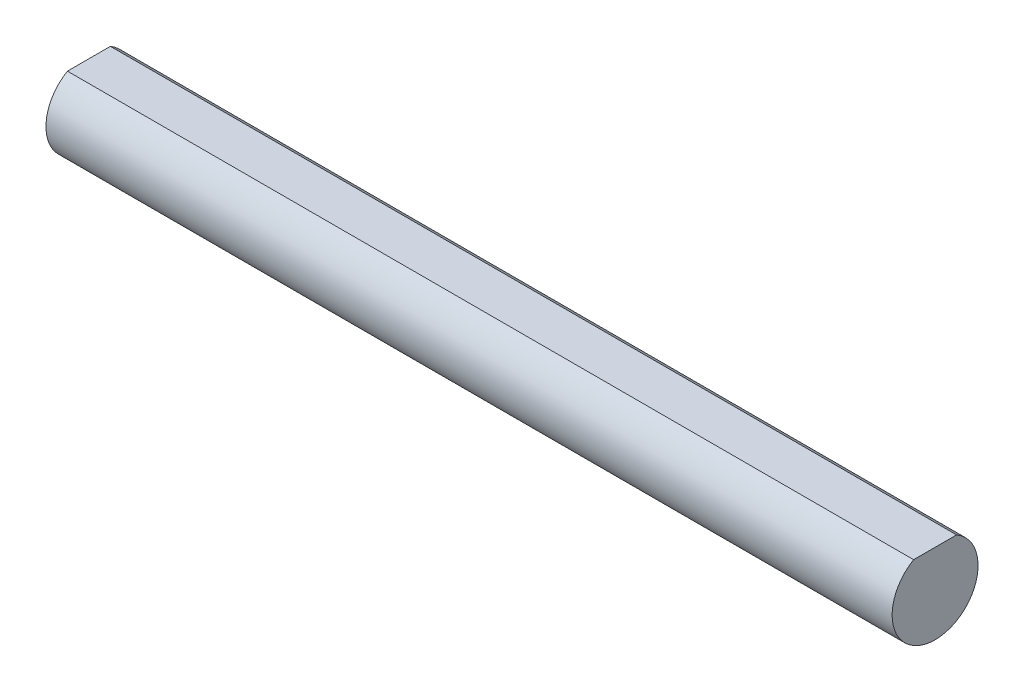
SolidWorks part; units mm, degrees
ref_plane "Front Plane" through (0, 0, 0) normal (0, 0, 1) x (1, 0, 0)
ref_plane "Top Plane" through (0, 0, 0) normal (0, 1, 0) x (1, 0, 0)
ref_plane "Right Plane" through (0, 0, 0) normal (1, 0, 0) x (0, 0, -1)
sketch "Sketch1" plane through (0, 0, 0) normal (1, 0, 0) x (0, 0, -1)
  line L1 (1.5, 2.5981) -> (-1.5, 2.5981)
  line L2 (-1.5, 2.5981) -> (-3, 0) construction
  line L3 (-3, 0) -> (-1.5, -2.5981) construction
  line L4 (-1.5, -2.5981) -> (1.5, -2.5981) construction
  line L5 (1.5, -2.5981) -> (3, 0) construction
  line L6 (3, 0) -> (1.5, 2.5981) construction
  circle A0 centre (0, 0) radius 2.5981 construction
  arc A1 (-1.5, 2.5981) -> (1.5, 2.5981) centre (0, 0) ccw
  dimension "D2" = 6
extrude "Boss-Extrude1" add sketch "Sketch1" along normal blind 59.1
